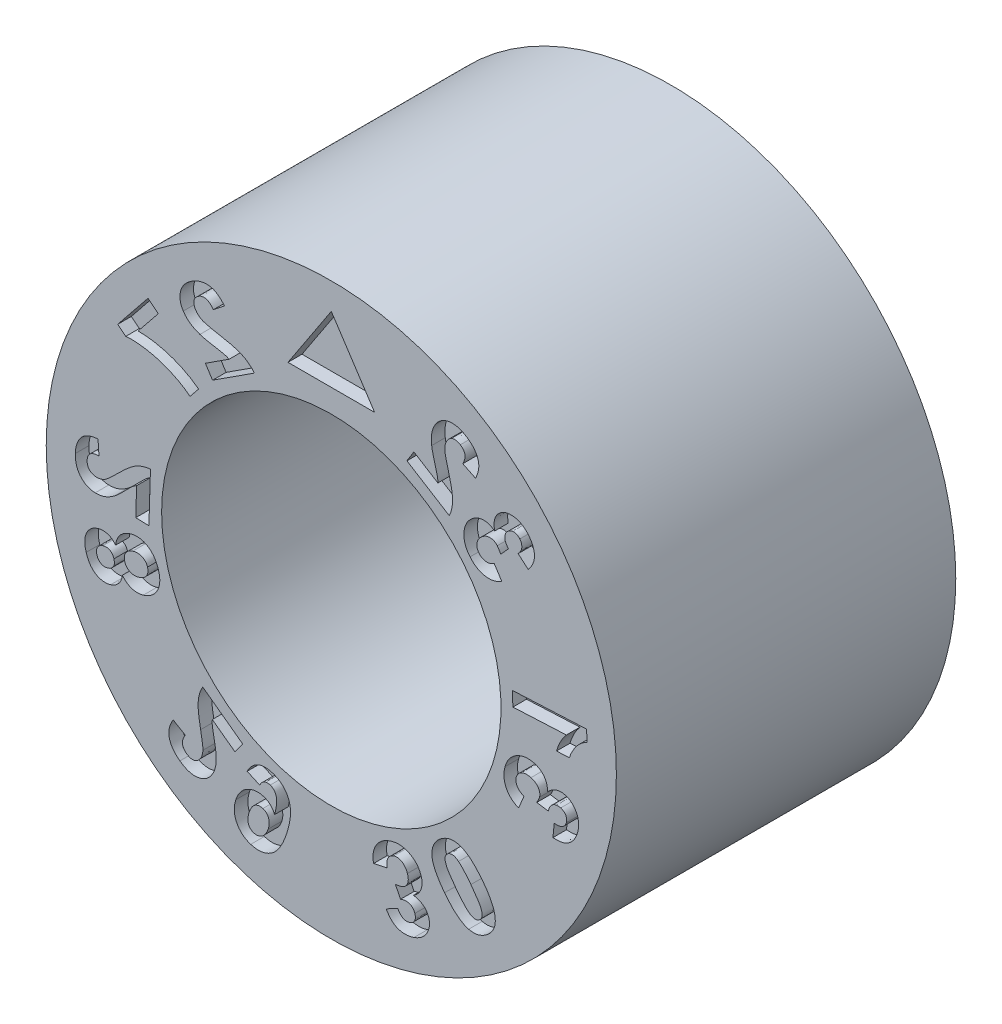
SolidWorks part; units mm, degrees
ref_plane "Front Plane" through (0, 0, 0) normal (0, 0, 1) x (1, 0, 0)
ref_plane "Top Plane" through (0, 0, 0) normal (0, 1, 0) x (1, 0, 0)
ref_plane "Right Plane" through (0, 0, 0) normal (1, 0, 0) x (0, 0, -1)
imported_body "Imported1"
other "DeleteFace1"
other "Move Face1" parameters "D1"=0.11
sketch "Sketch1" plane through (0, 0, 0) normal (0, 0, 1) x (1, 0, 0)
  line L0 (0, 0) -> (0, -2.7629) construction
  line L1 (0, 0) -> (-2.461, 1.4208) construction
  line L2 (0, 0) -> (2.4143, 1.3939) construction
  line L3 (0, 0) -> (2.7175, -1.569) construction
  line L4 (0, 0) -> (-2.7175, -1.569) construction
  line L5 (0, -1.485) -> (0, 1.485) construction
  arc A0 (-0.5502, 1.2383) -> (0.5768, 1.2261) centre (0, 0) ccw construction
  text T2 "27  28  29  30  31  32" font "Arial" height 0.55
  dimension "D1" = 2.71
  dimension "D2" = 60
  dimension "D3" = 60
extrude "Cut-Extrude1" cut sketch "Sketch1" against normal blind 0.1
other "Move Face2" parameters "D1"=0.5
sketch "Sketch2" plane through (0, 0, 0) normal (0, 1, 0) x (1, 0, 0)
  line L0 (2.1, 2.5) -> (-2.1, 2.5) construction
  line L1 (-1.3, 2.5) -> (-1.7, 2.5)
  arc A0 (-1.3, 2.5) -> (-1.7, 2.5) centre (-1.5, 2.5) ccw
  dimension "D1" = 0.2
  dimension "D2" = 1.5
revolve "Revolve1" add sketch "Sketch2" angle 360 about L1
